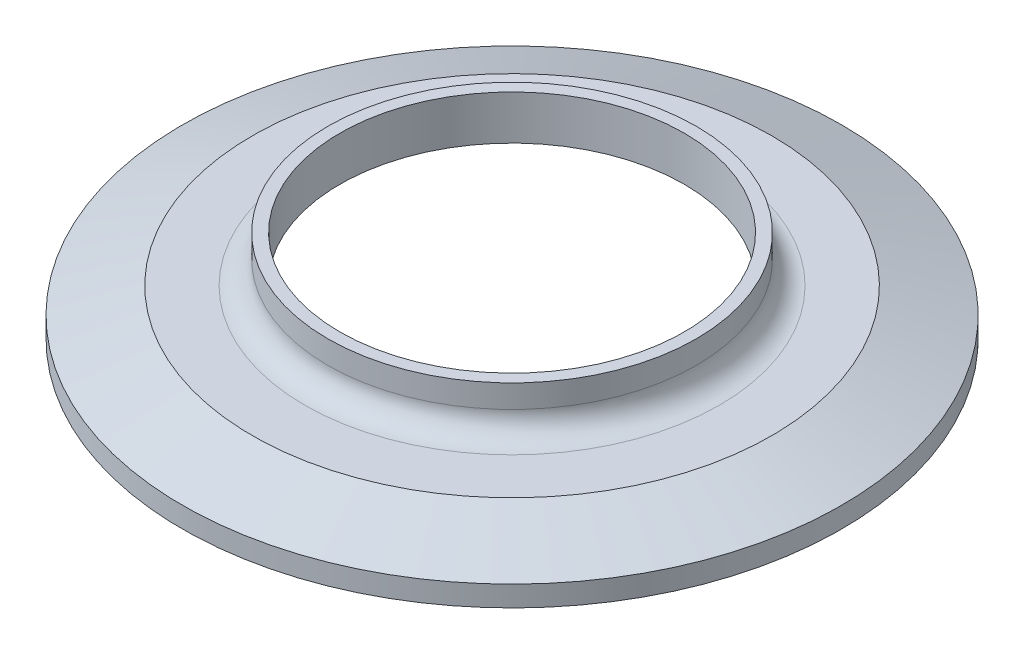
SolidWorks part; units mm, degrees
ref_plane "Front Plane" through (0, 0, 0) normal (0, 0, 1) x (1, 0, 0)
ref_plane "Top Plane" through (0, 0, 0) normal (0, 1, 0) x (1, 0, 0)
ref_plane "Right Plane" through (0, 0, 0) normal (1, 0, 0) x (0, 0, -1)
sketch "Sketch1" plane through (0, 0, 0) normal (0, 0, 1) x (1, 0, 0)
  line L0 (0, 0) -> (0, 8.8532) construction
  line L1 (-25.4, 12.7) -> (-25.4, 9.525)
  line L2 (-28.575, 6.35) -> (-35.8228, 6.35)
  line L3 (-35.8228, 6.35) -> (-45.4533, 2.8448)
  line L4 (-45.4533, 2.8448) -> (-45.4533, 0)
  line L5 (-45.4533, 0) -> (-43.6593, 0.0025)
  line L6 (-36.449, 0) -> (-39.6781, 0.0025)
  line L10 (-36.449, 0) -> (-23.749, 6.5915)
  line L11 (-23.749, 6.5915) -> (-23.749, 12.7)
  line L12 (-23.749, 12.7) -> (-25.4, 12.7)
  line L15 (-42.7676, 0.8754) -> (-42.9345, 0.4823)
  line L17 (-40.5698, 0.8754) -> (-40.4029, 0.4823)
  arc A0 (-28.575, 6.35) -> (-25.4, 9.525) centre (-28.575, 9.525) ccw
  arc A1 (-42.9345, 0.4823) -> (-43.6593, 0.0025) centre (-43.6593, 0.7899) cw
  arc A2 (-39.6781, 0.0025) -> (-40.4029, 0.4823) centre (-39.6781, 0.7899) cw
  arc A3 (-40.5698, 0.8754) -> (-42.7676, 0.8754) centre (-41.6687, 0.4089) ccw
  dimension "D3" = 3.175
  dimension "D7" = 0.7874
  dimension "D8" = 41.6687
  dimension "D9" = 0.7874
  dimension "D2" = 23.749
  dimension "D4" = 12.7
  dimension "D5" = 6.35
  dimension "D6" = 45.4533
  dimension "D10" = 20
  dimension "D11" = 36.449
  dimension "D12" = 25.4
  dimension "D13" = 2.8448
  dimension "D14" = 62.57
revolve "Revolve1" add sketch "Sketch1" angle 360 about L0
